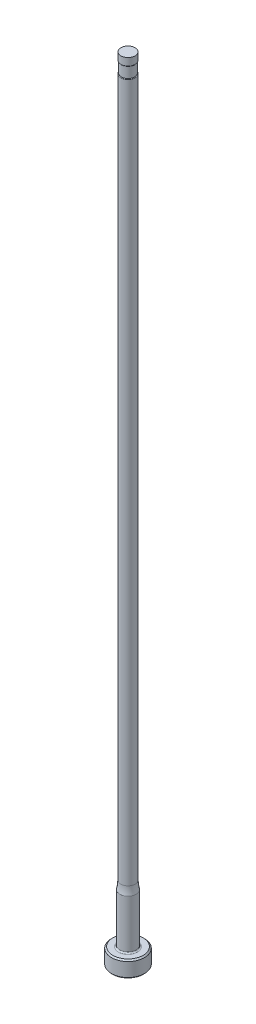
SolidWorks part; units mm, degrees
ref_plane "Front Plane" through (0, 0, 0) normal (0, 0, 1) x (1, 0, 0)
ref_plane "Top Plane" through (0, 0, 0) normal (0, 1, 0) x (1, 0, 0)
ref_plane "Right Plane" through (0, 0, 0) normal (1, 0, 0) x (0, 0, -1)
other "Configuration Table"
sketch "Sketch1" plane through (0, 0, 0) normal (0, 0, 1) x (1, 0, 0)
  line L0 (0, 259.9588) -> (0, -15.1925) construction
  line L1 (0, 0) -> (-3.175, 0)
  line L2 (-3.175, 0) -> (-3.175, 3.175)
  line L3 (-3.175, 3.175) -> (-1.5875, 3.175)
  line L4 (-1.3881, 14.2788) -> (-1.3881, 152.4)
  line L5 (-1.3881, 152.4) -> (0, 152.4)
  line L6 (0, 152.4) -> (0, 0)
  line L7 (-1.5875, 3.175) -> (-1.5875, 12.7)
  arc A1 (-1.5875, 12.7) -> (-1.3881, 14.2788) centre (-7.7381, 14.2788) ccw
  dimension "D1" = 6.35
  dimension "L" = 152.4
  dimension "D2" = 3.175
  dimension "H" = 6.35
  dimension "T" = 3.175
  dimension "D" = 2.7762
  dimension "S" = 12.7
revolve "Revolve1" add sketch "Sketch1" angle 360 about L0
chamfer "Chamfer1" distance 0.254 angle 45 2 edges at (0, 3.175, 3.175) (0, 0, 3.175)
fillet "Fillet1" radius 0.254 1 edges at (0, 3.175, 1.5875)
sketch "Sketch2" plane through (0, 0, 0) normal (0, 0, 1) x (1, 0, 0)
  line L0 (-1.3881, 152.4) -> (-1.3881, 14.2788) construction
  line L1 (-1.3881, 150.876) -> (-1.2865, 150.876)
  line L2 (-1.3881, 150.876) -> (-1.3881, 148.844)
  line L3 (-1.3881, 148.844) -> (-1.2865, 148.844)
  line L4 (-1.2865, 150.876) -> (-1.2865, 148.844)
  line L5 (1.3881, 152.4) -> (-1.3881, 152.4) construction
  line L6 (0, 153.4483) -> (0, 147.3282) construction
  dimension "D1" = 2.032
  dimension "N" = 1.524
  dimension "FD" = 0.1016
  dimension "D3" = 2.573
revolve "Vent Relief" cut sketch "Sketch2" angle 360 about L6
sketch "Sketch3" plane through (0, 0, 0) normal (0, 0, 1) x (1, 0, 0)
  line L0 (-1.2865, 149.86) -> (-1.2865, 111.76)
  line L1 (-1.2865, 150.876) -> (-1.2865, 148.844) construction
  line L2 (-1.3881, 148.844) -> (-1.3881, 14.2788) construction
  line L3 (-1.3881, 110.9632) -> (-1.3881, 149.86)
  line L4 (-1.3881, 149.86) -> (-1.2865, 149.86)
  arc A0 (-1.2865, 111.76) -> (-1.3881, 110.9632) centre (-4.4615, 111.76) cw
  dimension "D1" = 3.175
  dimension "D2" = 38.1
extrude "D-Slot" cut sketch "Sketch3" against normal through all both and the other way through all
sketch "Sketch5" plane through (0, 0, 0) normal (0, 0, 1) x (1, 0, 0)
  line L0 (-1.3881, 150.876) -> (1.3881, 150.876) construction
  line L1 (-1.3881, 152.4) -> (-1.3627, 152.4)
  line L2 (-1.3881, 152.4) -> (-1.3881, 150.876)
  line L3 (-1.3881, 150.876) -> (-1.3627, 150.876)
  line L4 (-1.3627, 152.4) -> (-1.3627, 150.876)
  line L5 (0, 152.6877) -> (0, 150.5771) construction
  dimension "VP" = 0.0254
revolve "Vent Diameter" cut sketch "Sketch5" angle 360 about L5
fillet "Fillet2" radius 0.127 2 edges at (1.3881, 148.844, 0) (0, 150.876, 1.3627)
sketch "Pocket Sketch" plane through (0, 0, 0) normal (0, 0, 1) x (1, 0, 0)
  line L0 (-3.5719, 0) -> (-3.5719, 3.2004)
  line L1 (-3.5719, 3.2004) -> (-2.3485, 3.2004)
  line L2 (-1.5865, 3.9624) -> (-1.5865, 22.225)
  line L3 (-1.5865, 22.225) -> (0, 22.225)
  line L4 (0, 22.225) -> (0, 0)
  line L5 (0, 0) -> (-3.5719, 0)
  line L6 (0, 12.6104) -> (0, -2.4989) construction
  line L7 (-3.175, 2.921) -> (-3.175, 0.254) construction
  line L8 (2.921, 3.175) -> (-2.921, 3.175) construction
  line L9 (-1.3881, 110.9632) -> (-1.3881, 14.2788) construction
  line L10 (-2.3485, 3.2004) -> (-1.5865, 3.9624)
  point P3 (-1.5865, 3.2004)
  dimension "D1" = 7.1437
  dimension "D2" = 0.3969
  dimension "D3" = 0.0254
  dimension "D4" = 0.1984
  dimension "D5" = 3.1731
  dimension "D6" = 22.225
